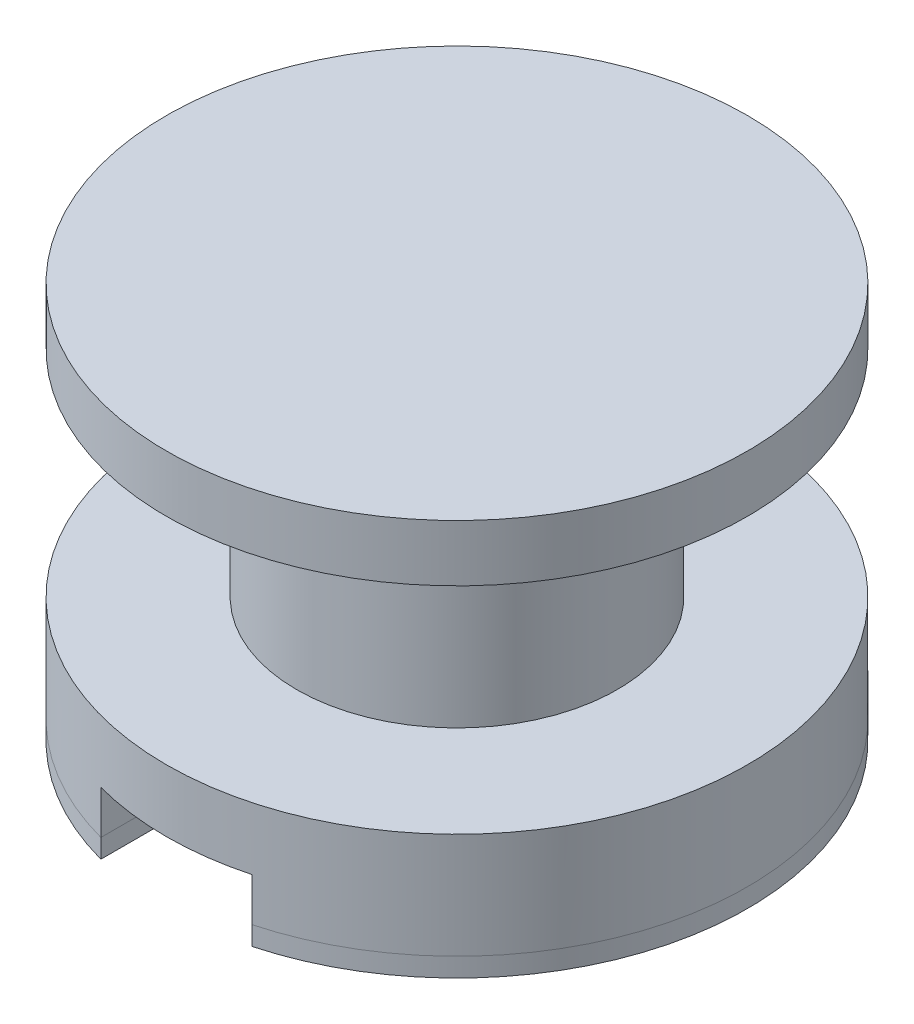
SolidWorks part; units mm, degrees
ref_plane "Front Plane" through (0, 0, 0) normal (0, 0, 1) x (1, 0, 0)
ref_plane "Top Plane" through (0, 0, 0) normal (0, 1, 0) x (1, 0, 0)
ref_plane "Right Plane" through (0, 0, 0) normal (1, 0, 0) x (0, 0, -1)
sketch "Sketch1" plane through (0, 0, 0) normal (0, 1, 0) x (1, 0, 0)
  circle A0 centre (0, 0) radius 3.9116
extrude "Boss-Extrude1" add sketch "Sketch1" along normal blind 1.6764
sketch "Sketch2" plane through (0, 0, 0) normal (0, -1, 0) x (1, 0, 0)
  line L1 (-1.016, -3.9116) -> (1.016, -3.9116)
  line L2 (-1.016, -3.9116) -> (-1.016, 3.9116)
  line L3 (-1.016, 3.9116) -> (1.016, 3.9116)
  line L4 (1.016, -3.9116) -> (1.016, 3.9116)
  line L5 (-1.016, -3.9116) -> (1.016, 3.9116) construction
  line L6 (-1.016, 3.9116) -> (1.016, -3.9116) construction
  point P0 (0, 0)
extrude "Cut-Extrude1" cut sketch "Sketch2" against normal blind 0.8382
sketch "Sketch3" plane through (0, 1.6764, 0) normal (0, 1, 0) x (1, 0, 0)
  circle A0 centre (0, 0) radius 2.159
extrude "Boss-Extrude2" add sketch "Sketch3" along normal blind 2.8956
sketch "Sketch4" plane through (0, 4.572, 0) normal (0, 1, 0) x (1, 0, 0)
  circle A0 centre (0, 0) radius 3.9116
extrude "Boss-Extrude3" add sketch "Sketch4" along normal blind 0.762
sketch "Sketch5" plane through (0, 0, 0) normal (0, -1, 0) x (1, 0, 0)
  circle A0 centre (0, 0) radius 3.9116
extrude "Cut-Extrude2" cut sketch "Sketch5" against normal blind 0.254
sketch "Sketch6" plane through (0, 0.254, 0) normal (0, -1, 0) x (1, 0, 0)
  line L0 (-1.016, 3.7773) -> (-1.016, -3.7773)
  line L1 (1.016, 3.7773) -> (1.016, -3.7773)
  arc A0 (-1.016, 3.7773) -> (-1.016, -3.7773) centre (0, 0) ccw
  arc A1 (1.016, -3.7773) -> (1.016, 3.7773) centre (0, 0) ccw
extrude "Boss-Extrude4" add sketch "Sketch6" along normal blind 0.254 separate body
